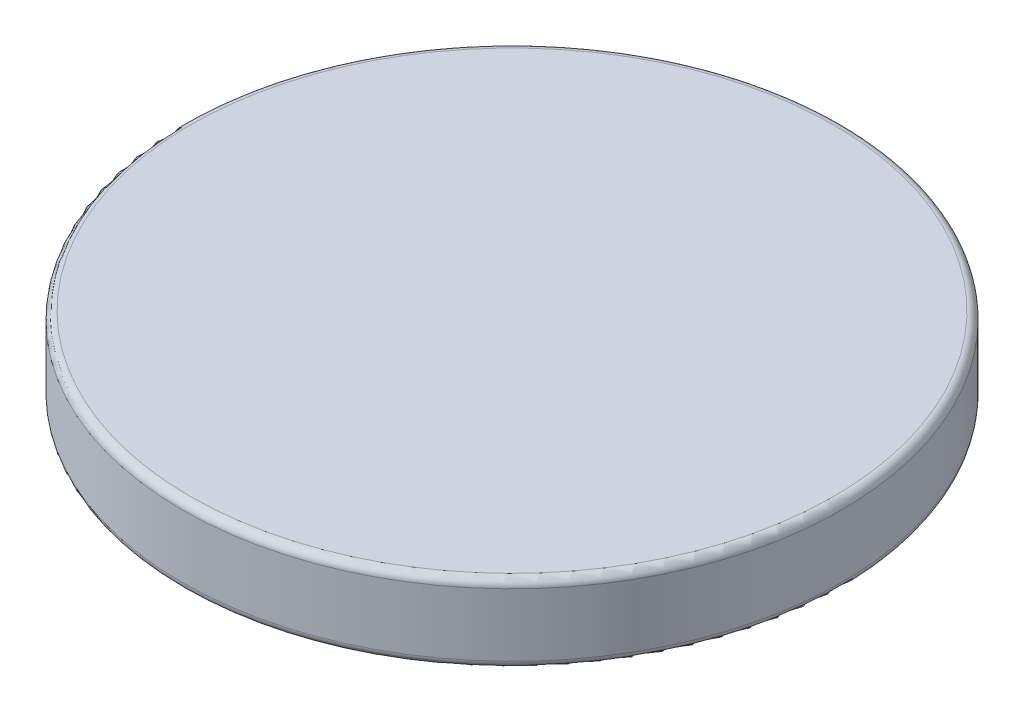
SolidWorks part; units mm, degrees
ref_plane "Спереди" through (0, 0, 0) normal (0, 0, 1) x (1, 0, 0)
ref_plane "Сверху" through (0, 0, 0) normal (0, 1, 0) x (1, 0, 0)
ref_plane "Справа" through (0, 0, 0) normal (1, 0, 0) x (0, 0, -1)
sketch "Эскиз1" plane through (0, 0, 0) normal (0, 1, 0) x (1, 0, 0)
  circle A0 centre (0, 0) radius 21
  dimension "D1" = 42
extrude "Бобышка-Вытянуть1" add sketch "Эскиз1" along normal blind 5
fillet "Скругление1" radius 0.5 2 edges at (0, 0, 21) (0, 5, 21)
